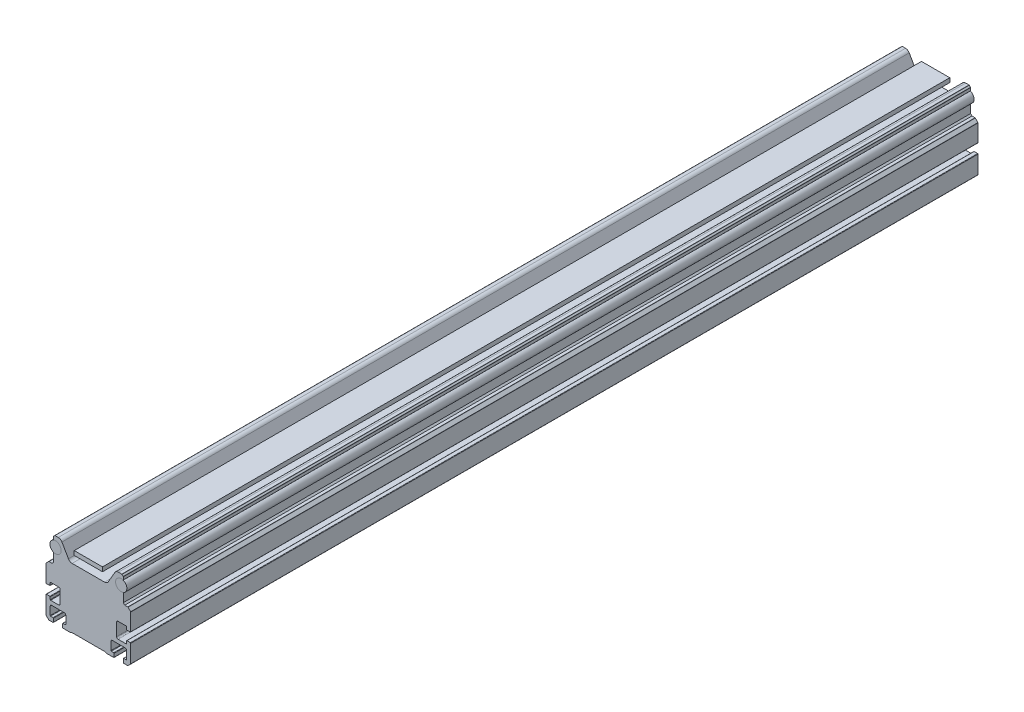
SolidWorks part; units mm, degrees
ref_plane "前视基准面" through (0, 0, 0) normal (0, 0, 1) x (1, 0, 0)
ref_plane "上视基准面" through (0, 0, 0) normal (0, 1, 0) x (1, 0, 0)
ref_plane "右视基准面" through (0, 0, 0) normal (1, 0, 0) x (0, 0, -1)
sketch "草图1" plane through (0, 0, 0) normal (0, 0, 1) x (1, 0, 0)
  line L0 (145.2119, 91.3814) -> (168.9634, 91.3814)
  line L1 (181.8376, 127.8814) -> (181.8376, 133.8877)
  line L2 (184.9634, 126.8814) -> (182.8376, 126.8814)
  line L3 (186.9998, 124.9693) -> (185.1755, 126.7936)
  line L4 (187.0876, 112.6814) -> (187.0876, 124.7572)
  line L5 (184.3876, 112.3814) -> (186.7876, 112.3814)
  line L6 (178.0876, 114.6314) -> (183.7876, 114.6314)
  line L7 (177.0876, 104.6314) -> (177.0876, 113.6314)
  line L8 (183.7876, 103.6314) -> (178.0876, 103.6314)
  line L9 (186.7876, 105.8814) -> (184.3876, 105.8814)
  line L10 (187.0876, 93.0057) -> (187.0876, 105.5814)
  line L11 (185.1755, 90.9693) -> (186.9998, 92.7936)
  line L12 (182.1376, 90.8814) -> (184.9634, 90.8814)
  line L13 (181.8376, 93.5814) -> (181.8376, 91.1814)
  line L14 (184.0876, 99.8814) -> (184.0876, 94.1814)
  line L15 (174.0876, 100.8814) -> (183.0876, 100.8814)
  line L16 (173.0876, 94.1814) -> (173.0876, 99.8814)
  line L17 (175.3376, 91.1814) -> (175.3376, 93.5814)
  line L18 (169.7119, 90.8814) -> (175.0376, 90.8814)
  line L19 (139.1376, 90.8814) -> (144.4634, 90.8814)
  line L20 (138.8376, 93.5814) -> (138.8376, 91.1814)
  line L21 (141.0876, 99.8814) -> (141.0876, 94.1814)
  line L22 (131.0876, 100.8814) -> (140.0876, 100.8814)
  line L23 (130.0876, 94.1814) -> (130.0876, 99.8814)
  line L24 (132.3376, 91.1814) -> (132.3376, 93.5814)
  line L25 (129.2119, 90.8814) -> (132.0376, 90.8814)
  line L26 (127.1755, 92.7936) -> (128.9998, 90.9693)
  line L27 (127.0876, 105.5814) -> (127.0876, 93.0057)
  line L28 (129.7876, 105.8814) -> (127.3876, 105.8814)
  line L29 (136.0876, 103.6314) -> (130.3876, 103.6314)
  line L30 (137.0876, 113.6314) -> (137.0876, 104.6314)
  line L31 (130.3876, 114.6314) -> (136.0876, 114.6314)
  line L32 (127.3876, 112.3814) -> (129.7876, 112.3814)
  line L33 (127.0876, 124.7572) -> (127.0876, 112.6814)
  line L34 (128.9998, 126.7936) -> (127.1755, 124.9693)
  line L35 (131.3376, 126.8814) -> (129.2119, 126.8814)
  line L36 (132.3376, 133.8877) -> (132.3376, 127.8814)
  line L37 (132.3376, 143.7572) -> (132.3376, 141.8752)
  line L38 (135.7727, 144.8814) -> (133.4619, 144.8814)
  line L39 (142.9896, 135.3814) -> (138.3707, 143.3814)
  line L40 (168.5876, 133.8814) -> (145.5876, 133.8814)
  line L41 (175.8045, 143.3814) -> (171.1857, 135.3814)
  line L42 (180.7134, 144.8814) -> (178.4026, 144.8814)
  line L43 (181.8376, 141.8752) -> (181.8376, 143.7572)
  line L44 (169.1755, 91.2936) -> (169.4998, 90.9693)
  line L45 (144.6755, 90.9693) -> (144.9998, 91.2936)
  line L46 (182.8376, 126.8814) -> (181.8376, 127.8814)
  line L47 (132.3376, 127.8814) -> (131.3376, 126.8814)
  line L48 (184.0876, 114.3314) -> (184.0876, 112.6814)
  line L49 (184.0876, 105.5814) -> (184.0876, 103.9314)
  line L50 (183.7876, 93.8814) -> (182.1376, 93.8814)
  line L51 (175.0376, 93.8814) -> (173.3876, 93.8814)
  line L52 (140.7876, 93.8814) -> (139.1376, 93.8814)
  line L53 (132.0376, 93.8814) -> (130.3876, 93.8814)
  line L54 (130.0876, 103.9314) -> (130.0876, 105.5814)
  line L55 (130.0876, 112.6814) -> (130.0876, 114.3314)
  line L56 (133.2498, 144.7936) -> (132.4255, 143.9693)
  line L57 (181.7498, 143.9693) -> (180.9255, 144.7936)
  line L58 (167.0876, 139.4914) -> (167.0876, 142.4914)
  line L59 (147.0876, 139.4914) -> (147.0876, 142.4914)
  line L60 (167.0876, 142.4914) -> (147.0876, 142.4914)
  line L61 (167.0876, 139.4914) -> (147.0876, 139.4914)
  arc A0 (169.1755, 91.2936) -> (168.9634, 91.3814) centre (168.9634, 91.0814) ccw
  arc A1 (145.2119, 91.3814) -> (144.9998, 91.2936) centre (145.2119, 91.0814) ccw
  arc A2 (181.5757, 134.0779) -> (181.5757, 141.685) centre (180.3376, 137.8814) ccw
  arc A3 (132.5995, 141.685) -> (132.5995, 134.0779) centre (133.8376, 137.8814) ccw
  arc A4 (138.3707, 143.3814) -> (135.7727, 144.8814) centre (135.7727, 141.8814) ccw
  arc A5 (142.9896, 135.3814) -> (145.5876, 133.8814) centre (145.5876, 136.8814) ccw
  arc A6 (168.5876, 133.8814) -> (171.1857, 135.3814) centre (168.5876, 136.8814) ccw
  arc A7 (178.4026, 144.8814) -> (175.8045, 143.3814) centre (178.4026, 141.8814) ccw
  arc A8 (181.8376, 133.8877) -> (181.5757, 134.0779) centre (181.6376, 133.8877) ccw
  arc A9 (181.5757, 141.685) -> (181.8376, 141.8752) centre (181.6376, 141.8752) ccw
  arc A10 (185.1755, 126.7936) -> (184.9634, 126.8814) centre (184.9634, 126.5814) ccw
  arc A11 (187.0876, 124.7572) -> (186.9998, 124.9693) centre (186.7876, 124.7572) ccw
  arc A12 (186.7876, 112.3814) -> (187.0876, 112.6814) centre (186.7876, 112.6814) ccw
  arc A13 (184.0876, 112.6814) -> (184.3876, 112.3814) centre (184.3876, 112.6814) ccw
  arc A14 (184.0876, 114.3314) -> (183.7876, 114.6314) centre (183.7876, 114.3314) ccw
  arc A15 (178.0876, 114.6314) -> (177.0876, 113.6314) centre (178.0876, 113.6314) ccw
  arc A16 (177.0876, 104.6314) -> (178.0876, 103.6314) centre (178.0876, 104.6314) ccw
  arc A17 (183.7876, 103.6314) -> (184.0876, 103.9314) centre (183.7876, 103.9314) ccw
  arc A18 (184.3876, 105.8814) -> (184.0876, 105.5814) centre (184.3876, 105.5814) ccw
  arc A19 (187.0876, 105.5814) -> (186.7876, 105.8814) centre (186.7876, 105.5814) ccw
  arc A20 (186.9998, 92.7936) -> (187.0876, 93.0057) centre (186.7876, 93.0057) ccw
  arc A21 (184.9634, 90.8814) -> (185.1755, 90.9693) centre (184.9634, 91.1814) ccw
  arc A22 (181.8376, 91.1814) -> (182.1376, 90.8814) centre (182.1376, 91.1814) ccw
  arc A23 (182.1376, 93.8814) -> (181.8376, 93.5814) centre (182.1376, 93.5814) ccw
  arc A24 (183.7876, 93.8814) -> (184.0876, 94.1814) centre (183.7876, 94.1814) ccw
  arc A25 (184.0876, 99.8814) -> (183.0876, 100.8814) centre (183.0876, 99.8814) ccw
  arc A26 (174.0876, 100.8814) -> (173.0876, 99.8814) centre (174.0876, 99.8814) ccw
  arc A27 (173.0876, 94.1814) -> (173.3876, 93.8814) centre (173.3876, 94.1814) ccw
  arc A28 (175.3376, 93.5814) -> (175.0376, 93.8814) centre (175.0376, 93.5814) ccw
  arc A29 (175.0376, 90.8814) -> (175.3376, 91.1814) centre (175.0376, 91.1814) ccw
  arc A30 (169.4998, 90.9693) -> (169.7119, 90.8814) centre (169.7119, 91.1814) ccw
  arc A31 (144.4634, 90.8814) -> (144.6755, 90.9693) centre (144.4634, 91.1814) ccw
  arc A32 (138.8376, 91.1814) -> (139.1376, 90.8814) centre (139.1376, 91.1814) ccw
  arc A33 (139.1376, 93.8814) -> (138.8376, 93.5814) centre (139.1376, 93.5814) ccw
  arc A34 (140.7876, 93.8814) -> (141.0876, 94.1814) centre (140.7876, 94.1814) ccw
  arc A35 (141.0876, 99.8814) -> (140.0876, 100.8814) centre (140.0876, 99.8814) ccw
  arc A36 (131.0876, 100.8814) -> (130.0876, 99.8814) centre (131.0876, 99.8814) ccw
  arc A37 (130.0876, 94.1814) -> (130.3876, 93.8814) centre (130.3876, 94.1814) ccw
  arc A38 (132.3376, 93.5814) -> (132.0376, 93.8814) centre (132.0376, 93.5814) ccw
  arc A39 (132.0376, 90.8814) -> (132.3376, 91.1814) centre (132.0376, 91.1814) ccw
  arc A40 (128.9998, 90.9693) -> (129.2119, 90.8814) centre (129.2119, 91.1814) ccw
  arc A41 (127.0876, 93.0057) -> (127.1755, 92.7936) centre (127.3876, 93.0057) ccw
  arc A42 (127.3876, 105.8814) -> (127.0876, 105.5814) centre (127.3876, 105.5814) ccw
  arc A43 (130.0876, 105.5814) -> (129.7876, 105.8814) centre (129.7876, 105.5814) ccw
  arc A44 (130.0876, 103.9314) -> (130.3876, 103.6314) centre (130.3876, 103.9314) ccw
  arc A45 (136.0876, 103.6314) -> (137.0876, 104.6314) centre (136.0876, 104.6314) ccw
  arc A46 (137.0876, 113.6314) -> (136.0876, 114.6314) centre (136.0876, 113.6314) ccw
  arc A47 (130.3876, 114.6314) -> (130.0876, 114.3314) centre (130.3876, 114.3314) ccw
  arc A48 (129.7876, 112.3814) -> (130.0876, 112.6814) centre (129.7876, 112.6814) ccw
  arc A49 (127.0876, 112.6814) -> (127.3876, 112.3814) centre (127.3876, 112.6814) ccw
  arc A50 (127.1755, 124.9693) -> (127.0876, 124.7572) centre (127.3876, 124.7572) ccw
  arc A51 (129.2119, 126.8814) -> (128.9998, 126.7936) centre (129.2119, 126.5814) ccw
  arc A52 (132.5995, 134.0779) -> (132.3376, 133.8877) centre (132.5376, 133.8877) ccw
  arc A53 (132.3376, 141.8752) -> (132.5995, 141.685) centre (132.5376, 141.8752) ccw
  arc A54 (132.4255, 143.9693) -> (132.3376, 143.7572) centre (132.6376, 143.7572) ccw
  arc A55 (133.4619, 144.8814) -> (133.2498, 144.7936) centre (133.4619, 144.5814) ccw
  arc A56 (180.9255, 144.7936) -> (180.7134, 144.8814) centre (180.7134, 144.5814) ccw
  arc A57 (181.8376, 143.7572) -> (181.7498, 143.9693) centre (181.5376, 143.7572) ccw
extrude "凸台-拉伸1" add sketch "草图1" along normal blind 600
sketch "草图2" plane through (0, 0, 600) normal (0, 0, 1) x (1, 0, 0)
  line L0 (157.0876, 133.8814) -> (157.0876, 106.9606) construction
  line L1 (134.3376, 131.8814) -> (179.8376, 131.8814)
  line L2 (134.3376, 131.8814) -> (134.3376, 117.6314)
  line L3 (134.3376, 117.6314) -> (179.8376, 117.6314)
  line L4 (179.8376, 131.8814) -> (179.8376, 117.6314)
  line L5 (168.5876, 133.8814) -> (145.5876, 133.8814) construction
  line L7 (143.0876, 115.6314) -> (171.0876, 115.6314)
  line L8 (143.0876, 115.6314) -> (143.0876, 93.3814)
  line L9 (143.0876, 93.3814) -> (171.0876, 93.3814)
  line L10 (171.0876, 115.6314) -> (171.0876, 93.3814)
  line L11 (181.8376, 127.8814) -> (181.8376, 133.8877) construction
  line L12 (178.0876, 114.6314) -> (183.7876, 114.6314) construction
  line L13 (173.0876, 94.1814) -> (173.0876, 99.8814) construction
  line L14 (145.2119, 91.3814) -> (168.9634, 91.3814) construction
  dimension "D1" = 2
  dimension "D2" = 2
  dimension "D3" = 3
  dimension "D4" = 2
  dimension "D5" = 2
  dimension "D6" = 2
extrude "切除-拉伸1" cut sketch "草图2" against normal through all
sketch "草图3" plane through (0, 0, 600) normal (0, 0, 1) x (1, 0, 0)
  line L0 (157.0876, 133.8814) -> (157.0876, 146.3512) construction
  line L1 (168.5876, 133.8814) -> (145.5876, 133.8814) construction
  circle A0 centre (133.8376, 137.8814) radius 4
  circle A1 centre (180.3376, 137.8814) radius 4
extrude "切除-拉伸2" cut sketch "草图3" against normal through all
sketch "草图4" plane through (0, 0, 600) normal (0, 0, 1) x (1, 0, 0)
  line L0 (134.3376, 117.6314) -> (179.8376, 117.6314) construction
  line L1 (129.0876, 124.8814) -> (185.0876, 124.8814)
  line L2 (129.0876, 124.8814) -> (129.0876, 117.6314)
  line L3 (129.0876, 117.6314) -> (185.0876, 117.6314)
  line L4 (185.0876, 124.8814) -> (185.0876, 117.6314)
  line L5 (157.0876, 133.8814) -> (157.0876, 107.4685) construction
  line L6 (168.5876, 133.8814) -> (145.5876, 133.8814) construction
  line L7 (184.9634, 126.8814) -> (182.8376, 126.8814) construction
  line L8 (187.0876, 112.6814) -> (187.0876, 124.7572) construction
  line L9 (171.0876, 115.6314) -> (143.0876, 115.6314) construction
  line L10 (139.0876, 115.6314) -> (175.0876, 115.6314)
  line L11 (139.0876, 115.6314) -> (139.0876, 102.8814)
  line L12 (139.0876, 102.8814) -> (175.0876, 102.8814)
  line L13 (175.0876, 115.6314) -> (175.0876, 102.8814)
  line L14 (137.0876, 113.6314) -> (137.0876, 104.6314) construction
  line L15 (131.0876, 100.8814) -> (140.0876, 100.8814) construction
  dimension "D1" = 2
  dimension "D2" = 2
  dimension "D3" = 2
  dimension "D4" = 2
extrude "切除-拉伸3" cut sketch "草图4" against normal through all
fillet "圆角1" radius 3 2 edges at (129.0876, 124.8814, 300) (185.0876, 124.8814, 300)
fillet "圆角2" radius 2 6 edges at (175.0876, 102.8814, 300) (139.0876, 102.8814, 300) (139.0876, 115.6314, 300) (175.0876, 115.6314, 300) (185.0876, 117.6314, 300) (129.0876, 117.6314, 300)
fillet "圆角3" radius 1 4 edges at (143.0876, 102.8814, 300) (171.0876, 102.8814, 300) (179.8376, 124.8814, 300) (134.3376, 124.8814, 300)
sketch "草图5" plane through (0, 0, 600) normal (0, 0, 1) x (1, 0, 0)
  line L1 (157.0876, 131.8814) -> (157.0876, 125.1942) construction
  line L2 (134.3376, 131.8814) -> (141.3376, 131.8814)
  line L3 (134.3376, 131.8814) -> (134.3376, 126.1814)
  line L4 (134.3376, 126.1814) -> (141.3376, 126.1814)
  line L5 (141.3376, 131.8814) -> (141.3376, 126.1814)
  line L6 (179.8376, 131.8814) -> (134.3376, 131.8814) construction
  line L7 (172.8376, 131.8814) -> (172.8376, 126.1814)
  line L8 (179.8376, 126.1814) -> (172.8376, 126.1814)
  line L9 (179.8376, 131.8814) -> (179.8376, 126.1814)
  line L10 (179.8376, 131.8814) -> (172.8376, 131.8814)
  line L11 (164.5876, 93.3814) -> (164.5876, 99.3814)
  line L12 (143.0876, 93.3814) -> (149.5876, 93.3814)
  line L13 (143.0876, 93.3814) -> (143.0876, 99.3814)
  line L14 (143.0876, 99.3814) -> (149.5876, 99.3814)
  line L15 (149.5876, 93.3814) -> (149.5876, 99.3814)
  line L16 (171.0876, 99.3814) -> (164.5876, 99.3814)
  line L17 (171.0876, 93.3814) -> (171.0876, 99.3814)
  line L18 (171.0876, 93.3814) -> (164.5876, 93.3814)
  dimension "D1" = 7
  dimension "D2" = 5.7
  dimension "D3" = 6
  dimension "D4" = 6.5
extrude "凸台-拉伸2" add sketch "草图5" against normal up to surface (600 mm away)
sketch "草图6" plane through (0, 0, 600) normal (0, 0, 1) x (1, 0, 0)
  line L0 (157.0876, 133.8814) -> (157.0876, 82.7627) construction
  line L1 (168.5876, 133.8814) -> (145.5876, 133.8814) construction
  line L2 (145.2119, 91.3814) -> (168.9634, 91.3814) construction
  circle A0 centre (137.5876, 129.8814) radius 2.1
  circle A1 centre (176.5876, 129.8814) radius 2.1
  circle A2 centre (146.0876, 95.8814) radius 2.1
  circle A3 centre (168.0876, 95.8814) radius 2.1
  dimension "D1" = 4.2
  dimension "D3" = 39
  dimension "D4" = 22
  dimension "D5" = 4.5
  dimension "D2" = 4
extrude "切除-拉伸4" cut sketch "草图6" against normal through all
sketch "草图7" plane through (0, 0, 600) normal (0, 0, 1) x (1, 0, 0)
  line L0 (137.5876, 129.8814) -> (141.3376, 126.1814) construction
  line L1 (137.5876, 129.8814) -> (139.4937, 122.9543)
  line L2 (137.5876, 129.8814) -> (144.5398, 128.0685)
  line L3 (144.5398, 128.0685) -> (139.4937, 122.9543)
  line L4 (157.0876, 133.8814) -> (157.0876, 74.1515) construction
  line L5 (168.5876, 133.8814) -> (145.5876, 133.8814) construction
  line L6 (176.5876, 129.8814) -> (172.8376, 126.1814) construction
  line L7 (169.6355, 128.0685) -> (174.6816, 122.9543)
  line L8 (176.5876, 129.8814) -> (169.6355, 128.0685)
  line L9 (176.5876, 129.8814) -> (174.6816, 122.9543)
  line L10 (146.0876, 95.8814) -> (149.5876, 99.3814) construction
  line L11 (146.0876, 95.8814) -> (148.2286, 103.8718)
  line L12 (148.2286, 103.8718) -> (154.078, 98.0225)
  line L13 (146.0876, 95.8814) -> (154.078, 98.0225)
  line L14 (165.9466, 103.8718) -> (160.0973, 98.0225)
  line L15 (168.0876, 95.8814) -> (160.0973, 98.0225)
  line L16 (168.0876, 95.8814) -> (165.9466, 103.8718)
  dimension "D1" = 60
  dimension "D2" = 60
extrude "切除-拉伸5" cut sketch "草图7" against normal through all
fillet "圆角4" radius 2 8 edges at (172.8376, 131.8814, 300) (141.3376, 131.8814, 300) (179.8376, 126.1814, 300) (134.3376, 126.1814, 300) (171.0876, 99.3814, 300) (164.5876, 93.3814, 300) (149.5876, 93.3814, 300) (143.0876, 99.3814, 300)
fillet "圆角5" radius 0.5 15 edges at (138.1448, 127.8567, 300) (138.6057, 126.1814, 300) (139.6197, 129.3516, 300) (175.5696, 126.1814, 300) (176.0305, 127.8567, 300) (174.5556, 129.3516, 300) (141.3376, 128.9036, 300) (172.8376, 128.9036, 300) (166.0592, 96.425, 300) (167.1498, 99.3814, 300) (164.5876, 96.8193, 300) (146.6311, 97.9099, 300) (147.0255, 99.3814, 300) (148.1161, 96.425, 300) (149.5876, 96.8193, 300)
sketch "草图8" plane through (0, 0, 0) normal (0, 0, -1) x (-1, 0, 0)
  circle A0 centre (-180.3376, 137.8814) radius 4
  circle A1 centre (-133.8376, 137.8814) radius 4
extrude "凸台-拉伸3" add sketch "草图8" against normal up to surface (600 mm away) separate body
sketch "草图9" plane through (0, 0, 0) normal (0, 0, -1) x (-1, 0, 0)
  line L14 (-141.3376, 129.5507) -> (-141.3376, 129.8814)
  line L15 (-140.0565, 129.2376) -> (-140.7115, 129.0668)
  line L16 (-138.4316, 126.8141) -> (-138.2645, 127.4214)
  line L17 (-135.8095, 126.1814) -> (-137.9495, 126.1814)
  line L18 (-132.0876, 124.8814) -> (-133.3376, 124.8814)
  line L19 (-129.0876, 119.6314) -> (-129.0876, 121.8814)
  line L20 (-183.0876, 117.6314) -> (-131.0876, 117.6314)
  line L21 (-185.0876, 121.8814) -> (-185.0876, 119.6314)
  line L22 (-180.8376, 124.8814) -> (-182.0876, 124.8814)
  line L23 (-176.2257, 126.1814) -> (-178.3658, 126.1814)
  line L24 (-175.9107, 127.4214) -> (-175.7436, 126.8141)
  line L25 (-173.4638, 129.0668) -> (-174.1187, 129.2376)
  line L26 (-172.8376, 129.8814) -> (-172.8376, 129.5507)
  line L27 (-143.3376, 131.8814) -> (-170.8376, 131.8814)
  line L28 (-141.3376, 129.5507) -> (-141.3376, 129.8814)
  line L29 (-140.0565, 129.2376) -> (-140.7115, 129.0668)
  line L30 (-138.4316, 126.8141) -> (-138.2645, 127.4214)
  line L31 (-135.8095, 126.1814) -> (-137.9495, 126.1814)
  line L32 (-132.0876, 124.8814) -> (-133.3376, 124.8814)
  line L33 (-129.0876, 119.6314) -> (-129.0876, 121.8814)
  line L34 (-183.0876, 117.6314) -> (-131.0876, 117.6314)
  line L35 (-185.0876, 121.8814) -> (-185.0876, 119.6314)
  line L36 (-180.8376, 124.8814) -> (-182.0876, 124.8814)
  line L37 (-176.2257, 126.1814) -> (-178.3658, 126.1814)
  line L38 (-175.9107, 127.4214) -> (-175.7436, 126.8141)
  line L39 (-173.4638, 129.0668) -> (-174.1187, 129.2376)
  line L40 (-172.8376, 129.8814) -> (-172.8376, 129.5507)
  line L41 (-143.3376, 131.8814) -> (-170.8376, 131.8814)
  line L44 (-165.6231, 96.5418) -> (-165.217, 96.6506)
  line L45 (-167.3185, 98.752) -> (-167.5441, 97.9099)
  line L46 (-169.0876, 99.3814) -> (-167.8014, 99.3814)
  line L47 (-171.0876, 101.8814) -> (-171.0876, 101.3814)
  line L48 (-173.0876, 102.8814) -> (-172.0876, 102.8814)
  line L49 (-175.0876, 113.6314) -> (-175.0876, 104.8814)
  line L50 (-141.0876, 115.6314) -> (-173.0876, 115.6314)
  line L51 (-139.0876, 104.8814) -> (-139.0876, 113.6314)
  line L52 (-142.0876, 102.8814) -> (-141.0876, 102.8814)
  line L53 (-143.0876, 101.3814) -> (-143.0876, 101.8814)
  line L54 (-146.3738, 99.3814) -> (-145.0876, 99.3814)
  line L55 (-146.748, 98.346) -> (-146.8568, 98.752)
  line L56 (-148.9582, 96.6506) -> (-148.5522, 96.5418)
  line L57 (-149.5876, 95.3814) -> (-149.5876, 96.1677)
  line L58 (-162.5876, 93.3814) -> (-151.5876, 93.3814)
  line L59 (-164.5876, 96.1677) -> (-164.5876, 95.3814)
  line L60 (-165.6231, 96.5418) -> (-165.217, 96.6506)
  line L61 (-167.3185, 98.752) -> (-167.5441, 97.9099)
  line L62 (-169.0876, 99.3814) -> (-167.8014, 99.3814)
  line L63 (-171.0876, 101.8814) -> (-171.0876, 101.3814)
  line L64 (-173.0876, 102.8814) -> (-172.0876, 102.8814)
  line L65 (-175.0876, 113.6314) -> (-175.0876, 104.8814)
  line L66 (-141.0876, 115.6314) -> (-173.0876, 115.6314)
  line L67 (-139.0876, 104.8814) -> (-139.0876, 113.6314)
  line L68 (-142.0876, 102.8814) -> (-141.0876, 102.8814)
  line L69 (-143.0876, 101.3814) -> (-143.0876, 101.8814)
  line L70 (-146.3738, 99.3814) -> (-145.0876, 99.3814)
  line L71 (-146.748, 98.346) -> (-146.8568, 98.752)
  line L72 (-148.9582, 96.6506) -> (-148.5522, 96.5418)
  line L73 (-149.5876, 95.3814) -> (-149.5876, 96.1677)
  line L74 (-162.5876, 93.3814) -> (-151.5876, 93.3814)
  line L75 (-164.5876, 96.1677) -> (-164.5876, 95.3814)
  arc A19 (-165.6231, 96.5418) -> (-165.9925, 96.0247) centre (-165.4937, 96.0588) ccw
  arc A20 (-141.3376, 129.5507) -> (-140.7115, 129.0668) centre (-140.8376, 129.5507) ccw
  arc A21 (-140.0565, 129.2376) -> (-139.6836, 129.7522) centre (-140.1827, 129.7215) ccw
  arc A22 (-137.745, 127.7873) -> (-139.6836, 129.7522) centre (-137.5876, 129.8814) ccw
  arc A23 (-137.745, 127.7873) -> (-138.2645, 127.4214) centre (-137.7824, 127.2888) ccw
  arc A24 (-138.4316, 126.8141) -> (-137.9495, 126.1814) centre (-137.9495, 126.6814) ccw
  arc A25 (-134.1616, 125.3148) -> (-135.8095, 126.1814) centre (-135.8095, 124.1814) ccw
  arc A26 (-134.1616, 125.3148) -> (-133.3376, 124.8814) centre (-133.3376, 125.8814) ccw
  arc A27 (-129.0876, 121.8814) -> (-132.0876, 124.8814) centre (-132.0876, 121.8814) ccw
  arc A28 (-131.0876, 117.6314) -> (-129.0876, 119.6314) centre (-131.0876, 119.6314) ccw
  arc A29 (-185.0876, 119.6314) -> (-183.0876, 117.6314) centre (-183.0876, 119.6314) ccw
  arc A30 (-182.0876, 124.8814) -> (-185.0876, 121.8814) centre (-182.0876, 121.8814) ccw
  arc A31 (-180.8376, 124.8814) -> (-180.0137, 125.3148) centre (-180.8376, 125.8814) ccw
  arc A32 (-178.3658, 126.1814) -> (-180.0137, 125.3148) centre (-178.3658, 124.1814) ccw
  arc A33 (-176.2257, 126.1814) -> (-175.7436, 126.8141) centre (-176.2257, 126.6814) ccw
  arc A34 (-175.9107, 127.4214) -> (-176.4303, 127.7873) centre (-176.3928, 127.2888) ccw
  arc A35 (-174.4916, 129.7522) -> (-176.4303, 127.7873) centre (-176.5876, 129.8814) ccw
  arc A36 (-174.4916, 129.7522) -> (-174.1187, 129.2376) centre (-173.9926, 129.7215) ccw
  arc A37 (-173.4638, 129.0668) -> (-172.8376, 129.5507) centre (-173.3376, 129.5507) ccw
  arc A38 (-170.8376, 131.8814) -> (-172.8376, 129.8814) centre (-170.8376, 129.8814) ccw
  arc A39 (-141.3376, 129.8814) -> (-143.3376, 131.8814) centre (-143.3376, 129.8814) ccw
  arc A40 (-141.3376, 129.5507) -> (-140.7115, 129.0668) centre (-140.8376, 129.5507) ccw
  arc A41 (-140.0565, 129.2376) -> (-139.6836, 129.7522) centre (-140.1827, 129.7215) ccw
  arc A42 (-137.745, 127.7873) -> (-139.6836, 129.7522) centre (-137.5876, 129.8814) ccw
  arc A43 (-137.745, 127.7873) -> (-138.2645, 127.4214) centre (-137.7824, 127.2888) ccw
  arc A44 (-138.4316, 126.8141) -> (-137.9495, 126.1814) centre (-137.9495, 126.6814) ccw
  arc A45 (-134.1616, 125.3148) -> (-135.8095, 126.1814) centre (-135.8095, 124.1814) ccw
  arc A46 (-134.1616, 125.3148) -> (-133.3376, 124.8814) centre (-133.3376, 125.8814) ccw
  arc A47 (-129.0876, 121.8814) -> (-132.0876, 124.8814) centre (-132.0876, 121.8814) ccw
  arc A48 (-131.0876, 117.6314) -> (-129.0876, 119.6314) centre (-131.0876, 119.6314) ccw
  arc A49 (-185.0876, 119.6314) -> (-183.0876, 117.6314) centre (-183.0876, 119.6314) ccw
  arc A50 (-182.0876, 124.8814) -> (-185.0876, 121.8814) centre (-182.0876, 121.8814) ccw
  arc A51 (-180.8376, 124.8814) -> (-180.0137, 125.3148) centre (-180.8376, 125.8814) ccw
  arc A52 (-178.3658, 126.1814) -> (-180.0137, 125.3148) centre (-178.3658, 124.1814) ccw
  arc A53 (-176.2257, 126.1814) -> (-175.7436, 126.8141) centre (-176.2257, 126.6814) ccw
  arc A54 (-175.9107, 127.4214) -> (-176.4303, 127.7873) centre (-176.3928, 127.2888) ccw
  arc A55 (-174.4916, 129.7522) -> (-176.4303, 127.7873) centre (-176.5876, 129.8814) ccw
  arc A56 (-174.4916, 129.7522) -> (-174.1187, 129.2376) centre (-173.9926, 129.7215) ccw
  arc A57 (-173.4638, 129.0668) -> (-172.8376, 129.5507) centre (-173.3376, 129.5507) ccw
  arc A58 (-170.8376, 131.8814) -> (-172.8376, 129.8814) centre (-170.8376, 129.8814) ccw
  arc A59 (-141.3376, 129.8814) -> (-143.3376, 131.8814) centre (-143.3376, 129.8814) ccw
  arc A60 (-167.5441, 97.9099) -> (-165.9925, 96.0247) centre (-168.0876, 95.8814) ccw
  arc A61 (-167.3185, 98.752) -> (-167.8014, 99.3814) centre (-167.8014, 98.8814) ccw
  arc A62 (-171.0876, 101.3814) -> (-169.0876, 99.3814) centre (-169.0876, 101.3814) ccw
  arc A63 (-171.0876, 101.8814) -> (-172.0876, 102.8814) centre (-172.0876, 101.8814) ccw
  arc A64 (-175.0876, 104.8814) -> (-173.0876, 102.8814) centre (-173.0876, 104.8814) ccw
  arc A65 (-173.0876, 115.6314) -> (-175.0876, 113.6314) centre (-173.0876, 113.6314) ccw
  arc A66 (-139.0876, 113.6314) -> (-141.0876, 115.6314) centre (-141.0876, 113.6314) ccw
  arc A67 (-141.0876, 102.8814) -> (-139.0876, 104.8814) centre (-141.0876, 104.8814) ccw
  arc A68 (-142.0876, 102.8814) -> (-143.0876, 101.8814) centre (-142.0876, 101.8814) ccw
  arc A69 (-145.0876, 99.3814) -> (-143.0876, 101.3814) centre (-145.0876, 101.3814) ccw
  arc A70 (-146.3738, 99.3814) -> (-146.8568, 98.752) centre (-146.3738, 98.8814) ccw
  arc A71 (-146.748, 98.346) -> (-146.2309, 97.9765) centre (-146.265, 98.4754) ccw
  arc A72 (-148.1827, 96.0247) -> (-146.2309, 97.9765) centre (-146.0876, 95.8814) ccw
  arc A73 (-148.1827, 96.0247) -> (-148.5522, 96.5418) centre (-148.6816, 96.0588) ccw
  arc A74 (-148.9582, 96.6506) -> (-149.5876, 96.1677) centre (-149.0876, 96.1677) ccw
  arc A75 (-151.5876, 93.3814) -> (-149.5876, 95.3814) centre (-151.5876, 95.3814) ccw
  arc A76 (-164.5876, 95.3814) -> (-162.5876, 93.3814) centre (-162.5876, 95.3814) ccw
  arc A77 (-164.5876, 96.1677) -> (-165.217, 96.6506) centre (-165.0876, 96.1677) ccw
  arc A78 (-165.6231, 96.5418) -> (-165.9925, 96.0247) centre (-165.4937, 96.0588) ccw
  arc A79 (-167.5441, 97.9099) -> (-165.9925, 96.0247) centre (-168.0876, 95.8814) ccw
  arc A80 (-167.3185, 98.752) -> (-167.8014, 99.3814) centre (-167.8014, 98.8814) ccw
  arc A81 (-171.0876, 101.3814) -> (-169.0876, 99.3814) centre (-169.0876, 101.3814) ccw
  arc A82 (-171.0876, 101.8814) -> (-172.0876, 102.8814) centre (-172.0876, 101.8814) ccw
  arc A83 (-175.0876, 104.8814) -> (-173.0876, 102.8814) centre (-173.0876, 104.8814) ccw
  arc A84 (-173.0876, 115.6314) -> (-175.0876, 113.6314) centre (-173.0876, 113.6314) ccw
  arc A85 (-139.0876, 113.6314) -> (-141.0876, 115.6314) centre (-141.0876, 113.6314) ccw
  arc A86 (-141.0876, 102.8814) -> (-139.0876, 104.8814) centre (-141.0876, 104.8814) ccw
  arc A87 (-142.0876, 102.8814) -> (-143.0876, 101.8814) centre (-142.0876, 101.8814) ccw
  arc A88 (-145.0876, 99.3814) -> (-143.0876, 101.3814) centre (-145.0876, 101.3814) ccw
  arc A89 (-146.3738, 99.3814) -> (-146.8568, 98.752) centre (-146.3738, 98.8814) ccw
  arc A90 (-146.748, 98.346) -> (-146.2309, 97.9765) centre (-146.265, 98.4754) ccw
  arc A91 (-148.1827, 96.0247) -> (-146.2309, 97.9765) centre (-146.0876, 95.8814) ccw
  arc A92 (-148.1827, 96.0247) -> (-148.5522, 96.5418) centre (-148.6816, 96.0588) ccw
  arc A93 (-148.9582, 96.6506) -> (-149.5876, 96.1677) centre (-149.0876, 96.1677) ccw
  arc A94 (-151.5876, 93.3814) -> (-149.5876, 95.3814) centre (-151.5876, 95.3814) ccw
  arc A95 (-164.5876, 95.3814) -> (-162.5876, 93.3814) centre (-162.5876, 95.3814) ccw
  arc A96 (-164.5876, 96.1677) -> (-165.217, 96.6506) centre (-165.0876, 96.1677) ccw
  dimension "D1" = 0
  dimension "D2" = 0
extrude "凸台-拉伸4" add sketch "草图9" against normal up to surface (600 mm away)
